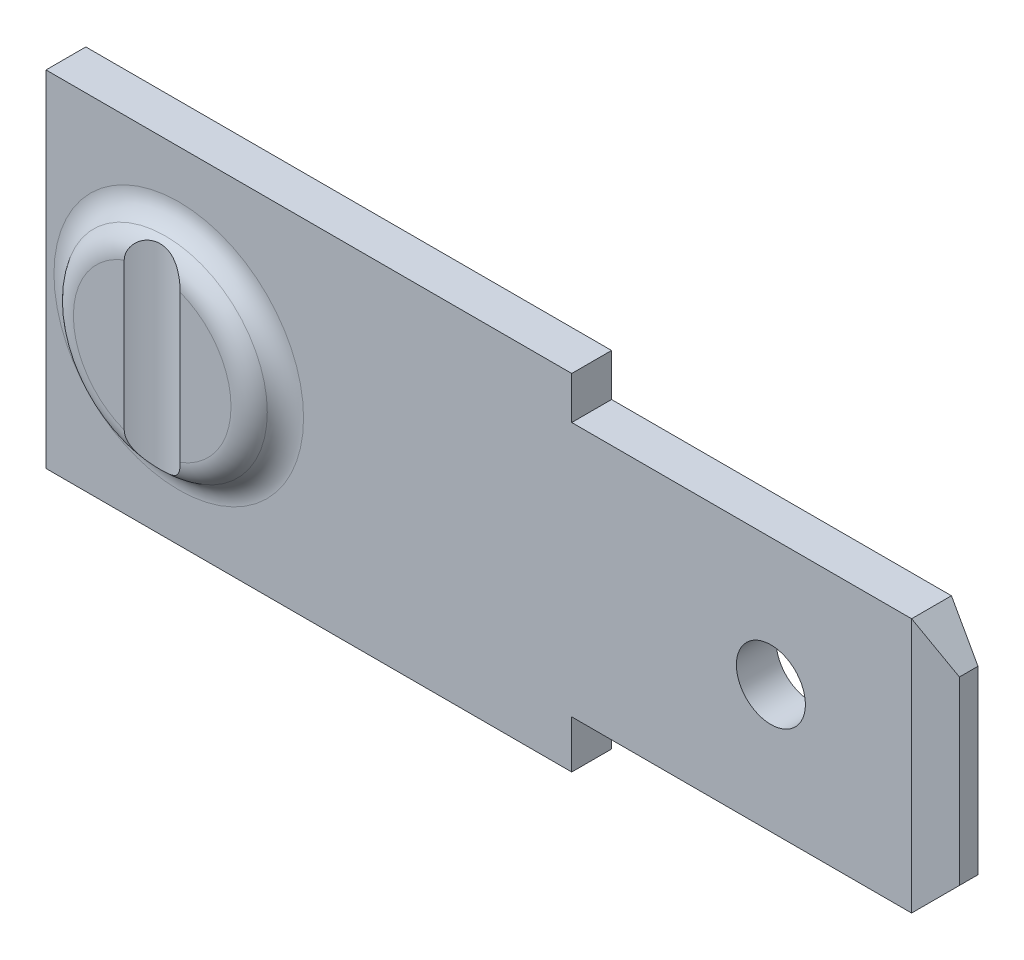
SolidWorks part; units mm, degrees
ref_plane "Plan de face" through (0, 0, 0) normal (0, 0, 1) x (1, 0, 0)
ref_plane "Plan de dessus" through (0, 0, 0) normal (0, 1, 0) x (1, 0, 0)
ref_plane "Plan de droite" through (0, 0, 0) normal (1, 0, 0) x (0, 0, -1)
sketch "Esquisse1" plane through (0, 0, 0) normal (0, 0, 1) x (1, 0, 0)
  line L0 (9.9, 5.7) -> (9.9, 6.5)
  line L1 (0, 0) -> (9.9, 0)
  line L2 (0, 0) -> (0, 6.5)
  line L3 (0, 6.5) -> (9.9, 6.5)
  line L4 (9.9, 0) -> (9.9, 0.9)
  line L5 (9.9, 5.7) -> (16.3, 5.7)
  line L6 (16.3, 5.7) -> (17, 5)
  line L7 (9.9, 0.9) -> (16.3, 0.9)
  line L8 (17, 5) -> (17, 1.6)
  line L9 (16.3, 0.9) -> (17, 1.6)
  line L10 (17, 3.3) -> (13.65, 3.3) construction
  circle A0 centre (13.65, 3.3) radius 0.65
  point P6 (17, 0.9)
  point P8 (17, 5.7)
  point P15 (14.3, 3.3)
  dimension "D6" = 1.3
  dimension "D1" = 6.5
  dimension "D2" = 9.9
  dimension "D3" = 4.8
  dimension "D4" = 5.6
  dimension "D5" = 17
  dimension "D8" = 0.7
  dimension "D9" = 0.7
  dimension "D7" = 2.7
extrude "Extrusion1" add sketch "Esquisse1" along normal blind 0.75
chamfer "Chanfrein1" distance 0.2 distance2 0.7 1 edges at (17, 3.3, 0.75)
chamfer "Chanfrein2" distance 0.7 distance2 0.2 1 edges at (17, 3.3, 0)
sketch "Esquisse2" plane through (0, 0, 0.75) normal (0, 0, 1) x (1, 0, 0)
  line L0 (0, 6.5) -> (0, 0) construction
  line L1 (9.9, 6.5) -> (0, 6.5) construction
  circle A0 centre (2.5, 3.25) radius 1.85
  dimension "D1" = 3.7
  dimension "D3" = 3.25
  dimension "D2" = 2.5
extrude "Extrusion2" add sketch "Esquisse2" along normal blind 0.5
fillet "Congé1" radius 0.5 1 edges at (0.65, 3.25, 0.75)
fillet "Congé2" radius 0.5 1 edges at (4.35, 3.25, 1.25)
sketch "Esquisse4" plane through (0, 0, 0) normal (0, -1, 0) x (1, 0, 0)
  line L0 (0, 0) -> (9.9, 0) construction
  circle A0 centre (2.5, 2.1) radius 1
  point P4 (0, 0)
  dimension "D1" = 2
  dimension "D2" = 2.1
extrude "Enlèv. mat.-Extru.1" cut sketch "Esquisse4" against normal through all
